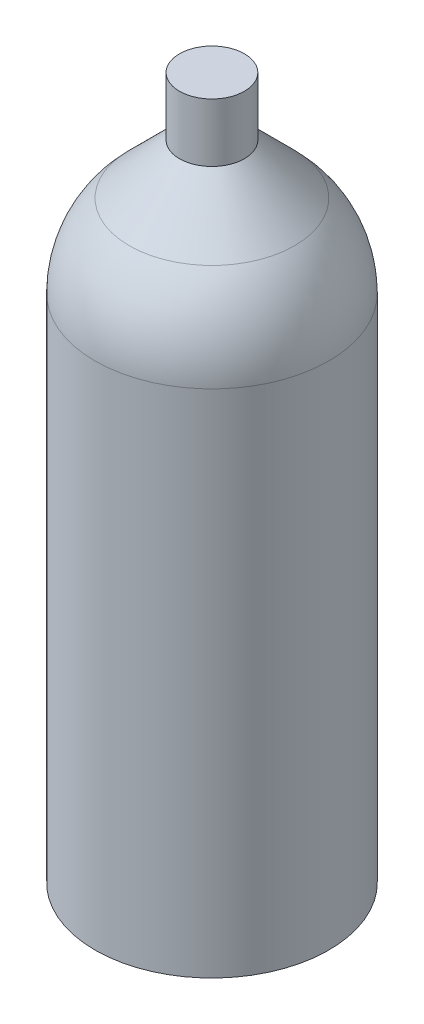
SolidWorks part; units mm, degrees
ref_plane "Plan de face" through (0, 0, 0) normal (0, 0, 1) x (1, 0, 0)
ref_plane "Plan de dessus" through (0, 0, 0) normal (0, 1, 0) x (1, 0, 0)
ref_plane "Plan de droite" through (0, 0, 0) normal (1, 0, 0) x (0, 0, -1)
sketch "Esquisse1" plane through (0, 0, 0) normal (0, 0, 1) x (1, 0, 0)
  line L0 (0, 67.574) -> (0, -40.1183) construction
  line L1 (2.7761, 60) -> (2.7761, 55)
  line L2 (0, 0) -> (10, 0)
  line L3 (0, 0) -> (0, 60)
  line L4 (0, 60) -> (2.7761, 60)
  line L5 (10, 0) -> (10, 47.7761)
  line L6 (2.7761, 55) -> (10, 47.7761)
  dimension "D1" = 5
revolve "Révolution1" add sketch "Esquisse1" angle 360 about L0
fillet "Congé1" radius 10 1 edges at (0, 47.7761, 10)
